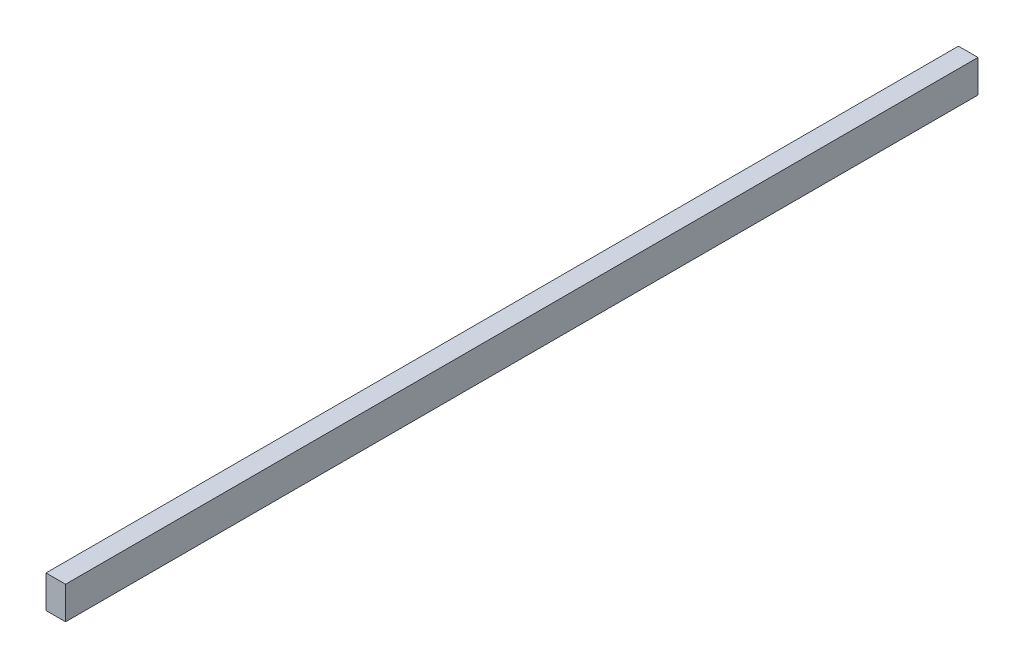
SolidWorks part; units mm, degrees
ref_plane "Face" through (0, 0, 0) normal (0, 0, 1) x (1, 0, 0)
ref_plane "Dessus" through (0, 0, 0) normal (0, 1, 0) x (1, 0, 0)
ref_plane "Droite" through (0, 0, 0) normal (1, 0, 0) x (0, 0, -1)
sketch "Esquisse1" plane through (0, 0, 0) normal (0, 0, 1) x (1, 0, 0)
  line L1 (0, 0) -> (18, 0)
  line L2 (0, 0) -> (0, 30)
  line L3 (0, 30) -> (18, 30)
  line L4 (18, 0) -> (18, 30)
  dimension "D1" = 18
  dimension "D2" = 30
extrude "Extrusion1" add sketch "Esquisse1" along normal blind 840
